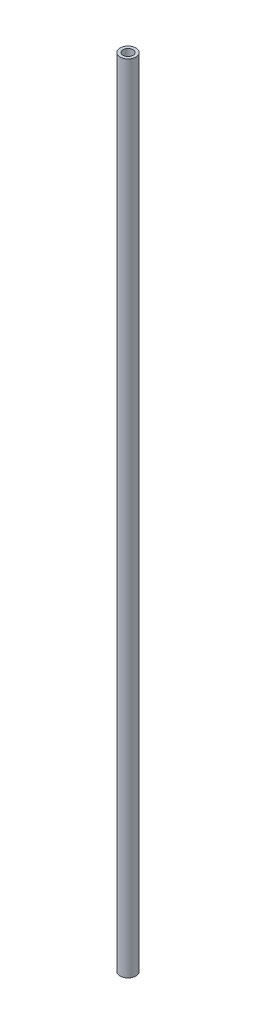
SolidWorks part; units mm, degrees
ref_plane "Alzado" through (0, 0, 0) normal (0, 0, 1) x (1, 0, 0)
ref_plane "Planta" through (0, 0, 0) normal (0, 1, 0) x (1, 0, 0)
ref_plane "Vista lateral" through (0, 0, 0) normal (1, 0, 0) x (0, 0, -1)
sketch "Croquis1" plane through (0, 0, 0) normal (0, 1, 0) x (1, 0, 0)
  circle A0 centre (0, 0) radius 4
  dimension "D1" = 8
extrude "Saliente-Extruir1" add sketch "Croquis1" along normal blind 400
sketch "Croquis2" plane through (0, 400, 0) normal (0, 1, 0) x (1, 0, 0)
  circle A0 centre (0, 0) radius 2.5
  dimension "D1" = 5
extrude "Cortar-Extruir1" cut sketch "Croquis2" against normal blind 5
sketch "Croquis3" plane through (0, 0, 0) normal (0, -1, 0) x (1, 0, 0)
  circle A0 centre (0, 0) radius 4
  dimension "D1" = 8
curve "Hélice/Espiral1"
